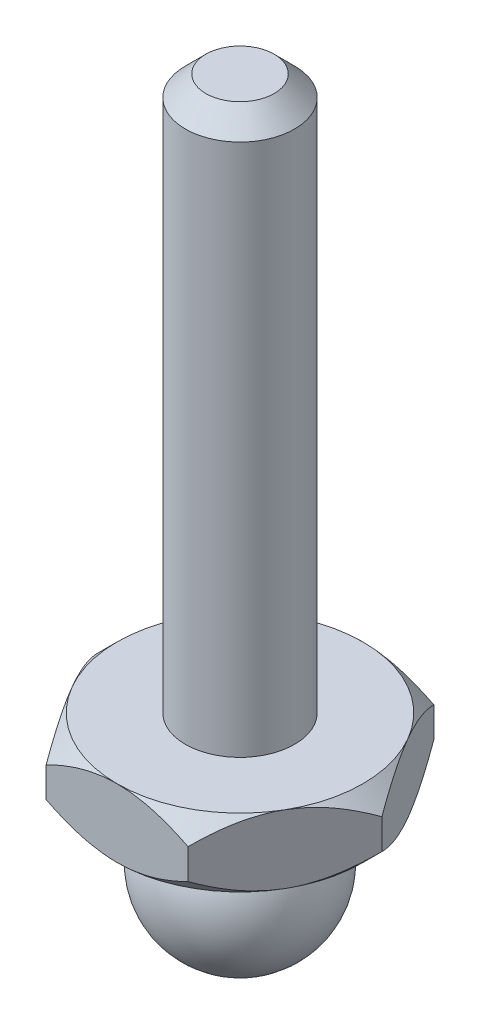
SolidWorks part; units mm, degrees
ref_plane "Front Plane" through (0, 0, 0) normal (0, 0, 1) x (1, 0, 0)
ref_plane "Top Plane" through (0, 0, 0) normal (0, 1, 0) x (1, 0, 0)
ref_plane "Right Plane" through (0, 0, 0) normal (1, 0, 0) x (0, 0, -1)
sketch "Sketch1" plane through (0, 0, 0) normal (0, 1, 0) x (1, 0, 0)
  circle A0 centre (0, 0) radius 4
  dimension "D1" = 8
extrude "Boss-Extrude1" add sketch "Sketch1" along normal blind 50
sketch "Sketch2" plane through (0, 0, 0) normal (1, 0, 0) x (0, 0, -1)
  line L0 (-4, 0) -> (4, 0) construction
  line L1 (0, 6) -> (0, -6)
  line L2 (0, 0) -> (0, -15.908) construction
  arc A0 (0, 6) -> (0, -6) centre (0, 0) ccw
  dimension "D1" = 12
revolve "Revolve1" add sketch "Sketch2" angle 360 about L2
sketch "Sketch3" plane through (0, 0, 0) normal (1, 0, 0) x (0, 0, -1)
  line L0 (0, 0) -> (0, 4.4721) construction
  line L1 (4, 4.4721) -> (-4, 4.4721) construction
ref_plane "Plane1" through (0, 4.4721, 0) normal (0, 1, 0) x (-1, 0, 0)
sketch "Sketch4" plane through (0, 4.4721, 0) normal (0, 1, 0) x (-1, 0, 0)
  line L0 (10.3923, 0) -> (0, 0) construction
  line L1 (-10.3923, 0) -> (-5.1962, -9)
  line L2 (-5.1962, -9) -> (5.1962, -9)
  line L3 (5.1962, -9) -> (10.3923, 0)
  line L4 (10.3923, 0) -> (5.1962, 9)
  line L5 (5.1962, 9) -> (-5.1962, 9)
  line L6 (-5.1962, 9) -> (-10.3923, 0)
  circle A0 centre (0, 0) radius 9 construction
  dimension "D1" = 18
extrude "Boss-Extrude2" add sketch "Sketch4" along normal blind 5
sketch "Sketch5" plane through (0, 0, 0) normal (1, 0, 0) x (0, 0, -1)
  line L0 (-9, 9.4721) -> (-11, 9.4721)
  line L1 (-11, 9.4721) -> (-11, 7.4721)
  line L2 (-11, 7.4721) -> (-9, 9.4721)
  line L3 (-9, 4.4721) -> (-11, 4.4721)
  line L4 (-11, 4.4721) -> (-11, 6.4721)
  line L5 (-11, 6.4721) -> (-9, 4.4721)
  line L6 (0, 4.4721) -> (0, 6.9721) construction
  line L7 (0, 9.4721) -> (0, 4.4721) construction
  line L8 (0, 6.9721) -> (-5.0448, 6.9721) construction
  dimension "D1" = 45
  dimension "D2" = 2
revolve "Cut-Revolve1" cut sketch "Sketch5" angle 360 about L6
chamfer "Chamfer1" distance 1.5 angle 45 1 edges at (0, 50, 4)
